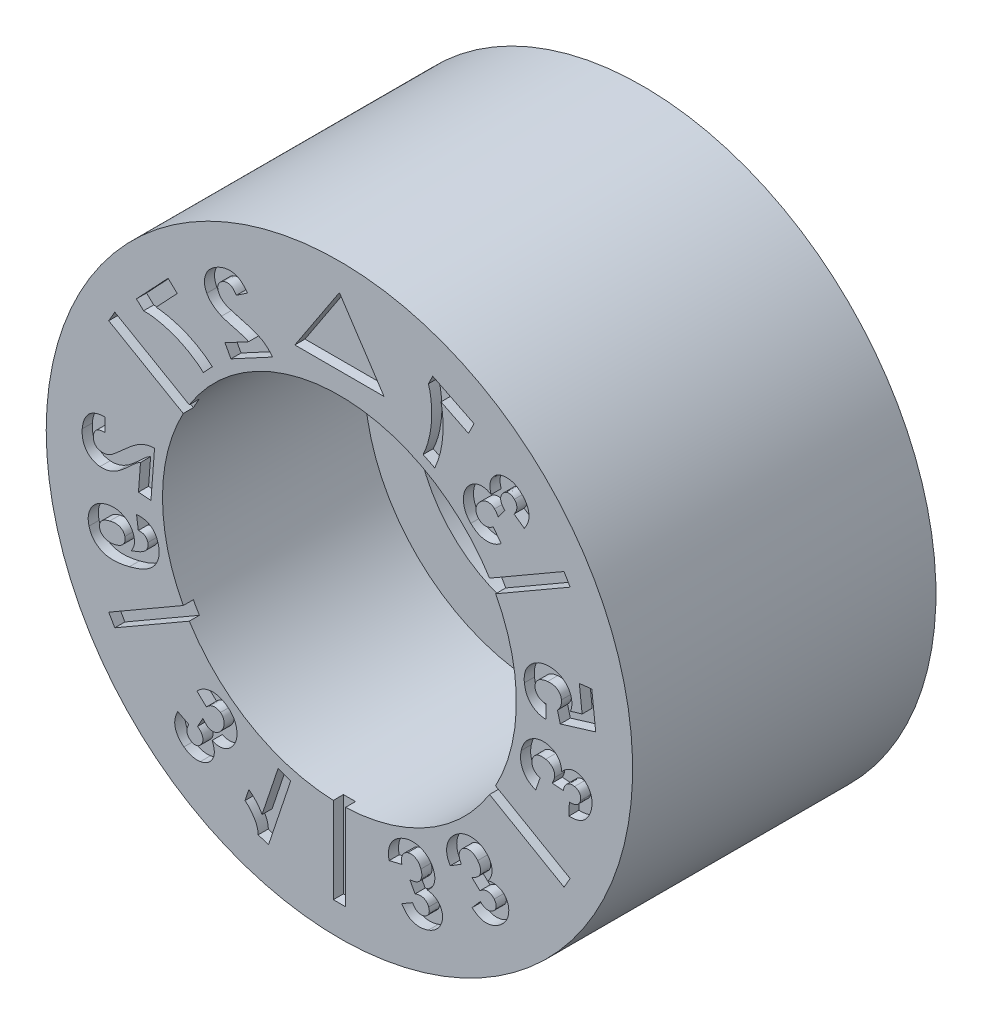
SolidWorks part; units mm, degrees
ref_plane "Front Plane" through (0, 0, 0) normal (0, 0, 1) x (1, 0, 0)
ref_plane "Top Plane" through (0, 0, 0) normal (0, 1, 0) x (1, 0, 0)
ref_plane "Right Plane" through (0, 0, 0) normal (1, 0, 0) x (0, 0, -1)
imported_body "Imported1"
other "Move Face2" parameters "D1"=0.157
other "DeleteFace1"
sketch "Sketch1" plane through (0, 0, 0) normal (0, 0, 1) x (1, 0, 0)
  line L0 (0, 0) -> (0, -3.3409) construction
  line L1 (0, 0) -> (-1.6705, -2.8933) construction
  line L3 (-0.06, -1.5) -> (0.06, -1.5)
  line L4 (-0.06, -1.5) -> (-0.06, -2.6)
  line L5 (-0.06, -2.6) -> (0.06, -2.6)
  line L6 (0.06, -1.5) -> (0.06, -2.6)
  line L11 (0, 0) -> (-2.8933, -1.6705) construction
  line L12 (-1.329, -0.698) -> (-1.269, -0.802)
  line L13 (-1.269, -0.802) -> (-2.2217, -1.352)
  line L14 (-1.329, -0.698) -> (-2.2817, -1.248)
  line L15 (-2.2817, -1.248) -> (-2.2217, -1.352)
  line L16 (0, 0) -> (-3.3409, 0) construction
  line L21 (0, 0) -> (-2.8933, 1.6705) construction
  line L22 (-1.269, 0.802) -> (-1.329, 0.698)
  line L23 (-1.329, 0.698) -> (-2.2817, 1.248)
  line L24 (-1.269, 0.802) -> (-2.2217, 1.352)
  line L25 (-2.2217, 1.352) -> (-2.2817, 1.248)
  line L26 (0, 0) -> (-1.6705, 2.8933) construction
  line L31 (0, 0) -> (0, 3.3409) construction
  line L36 (0, 0) -> (1.6705, 2.8933) construction
  line L41 (0, 0) -> (2.8933, 1.6705) construction
  line L42 (1.329, 0.698) -> (1.269, 0.802)
  line L43 (1.269, 0.802) -> (2.2217, 1.352)
  line L44 (1.329, 0.698) -> (2.2817, 1.248)
  line L45 (2.2817, 1.248) -> (2.2217, 1.352)
  line L46 (0, 0) -> (3.3409, 0) construction
  line L51 (0, 0) -> (2.8933, -1.6705) construction
  line L52 (1.269, -0.802) -> (1.329, -0.698)
  line L53 (1.329, -0.698) -> (2.2817, -1.248)
  line L54 (1.269, -0.802) -> (2.2217, -1.352)
  line L55 (2.2217, -1.352) -> (2.2817, -1.248)
  line L56 (0, 0) -> (1.6705, -2.8933) construction
  line L61 (0.06, 1.5) -> (0.06, 2.6)
  line L62 (-0.06, 1.5) -> (-0.06, 2.6)
  line L63 (0.06, 1.5) -> (-0.06, 1.5)
  line L64 (0.06, 2.6) -> (-0.06, 2.6)
  line L65 (0.802, 1.269) -> (1.352, 2.2217)
  line L66 (0.698, 1.329) -> (1.248, 2.2817)
  line L67 (1.352, 2.2217) -> (1.248, 2.2817)
  line L68 (0.802, 1.269) -> (0.698, 1.329)
  line L69 (-0.698, 1.329) -> (-1.248, 2.2817)
  line L70 (-1.248, 2.2817) -> (-1.352, 2.2217)
  line L71 (-0.802, 1.269) -> (-1.352, 2.2217)
  line L72 (-0.698, 1.329) -> (-0.802, 1.269)
  line L73 (1.5, 0.06) -> (2.6, 0.06)
  line L74 (1.5, -0.06) -> (2.6, -0.06)
  line L75 (1.5, -0.06) -> (1.5, 0.06)
  line L76 (2.6, -0.06) -> (2.6, 0.06)
  line L77 (-1.5, 0.06) -> (-2.6, 0.06)
  line L78 (-1.5, -0.06) -> (-2.6, -0.06)
  line L79 (-1.5, 0.06) -> (-1.5, -0.06)
  line L80 (-2.6, 0.06) -> (-2.6, -0.06)
  line L81 (0.802, -1.269) -> (1.352, -2.2217)
  line L82 (0.698, -1.329) -> (1.248, -2.2817)
  line L83 (-0.698, -1.329) -> (-1.248, -2.2817)
  line L84 (-0.802, -1.269) -> (-1.352, -2.2217)
  line L85 (-0.802, -1.269) -> (-0.698, -1.329)
  line L86 (0.698, -1.329) -> (0.802, -1.269)
  line L87 (1.248, -2.2817) -> (1.352, -2.2217)
  line L88 (-1.352, -2.2217) -> (-1.248, -2.2817)
  arc A0 (-0.6417, 1.7581) -> (0, 1.8715) centre (0, 0) ccw construction
  text T0 "27  29  31  33  35  37" font "Arial" height 0.7
  point P66 (0, 0)
  dimension "D1" = 3.743
  dimension "D6" = 12
extrude "Cut-Extrude1" cut sketch "Sketch1" against normal blind 0.1
